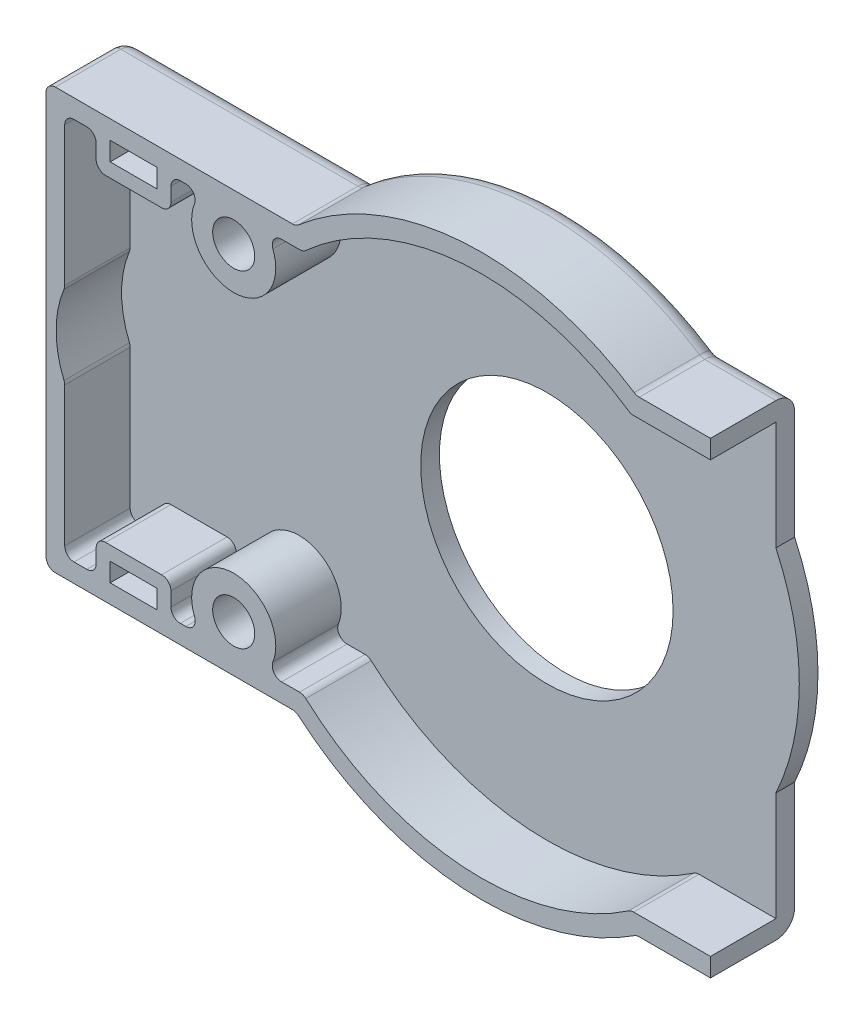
SolidWorks part; units mm, degrees
ref_plane "Спереди" through (0, 0, 0) normal (0, 0, 1) x (1, 0, 0)
ref_plane "Сверху" through (0, 0, 0) normal (0, 1, 0) x (1, 0, 0)
ref_plane "Справа" through (0, 0, 0) normal (1, 0, 0) x (0, 0, -1)
sketch "Эскиз1" plane through (0, 0, 0) normal (0, 0, 1) x (1, 0, 0)
  line L0 (0, 0) -> (24.5, 0) construction
  line L1 (24.5, -25) -> (24.5, -11.3468)
  line L2 (24.5, 25) -> (16.5831, 25)
  line L3 (24.5, -25) -> (16.5831, -25)
  line L4 (16.5831, 25) -> (-16.5831, 25) construction
  line L5 (16.5831, -25) -> (-16.5831, -25) construction
  line L6 (-16.5831, -22.5) -> (-16.5831, 22.5) construction
  line L7 (-16.5831, 0) -> (0, 0) construction
  line L8 (-16.5831, 22.5) -> (-19.8431, 22.5) construction
  line L9 (-16.5831, -22.5) -> (-19.8431, -22.5) construction
  line L10 (-19.8431, 22.5) -> (-46.5831, 22.5)
  line L11 (-46.5831, 22.5) -> (-46.5831, -22.5)
  line L12 (-46.5831, -22.5) -> (-19.8431, -22.5)
  line L13 (-46.5831, 0) -> (-16.5831, 0) construction
  line L17 (0, 30) -> (0, -30) construction
  line L23 (24.5, 11.3468) -> (24.5, 25)
  line L24 (24.5, 11.3468) -> (24.5, 0) construction
  line L25 (24.5, 0) -> (24.5, -11.3468) construction
  circle A0 centre (0, 0) radius 30 construction
  arc A1 (16.5831, 25) -> (-19.8431, 22.5) centre (0, 0) ccw
  arc A2 (-19.8431, -22.5) -> (16.5831, -25) centre (0, 0) ccw
  circle A7 centre (0, 0) radius 13.5
  arc A11 (24.5, 11.3468) -> (24.5, -11.3468) centre (0, 0) cw
  point P7 (24.5, 0)
  point P15 (-16.5831, 0)
  dimension "D1" = 60
  dimension "D4" = 45
  dimension "D6" = 27
  dimension "D11" = 27
  dimension "D2" = 50
  dimension "D3" = 24.5
  dimension "D5" = 30
extrude "Бобышка-Вытянуть1" add sketch "Эскиз1" along normal blind 2 contours L10 L11 L12 A2 L3 L1 L2 A1
sketch "Эскиз2" plane through (0, 0, 2) normal (0, 0, 1) x (1, 0, 0)
  line L7 (24.5, 25) -> (16.5831, 25) construction
  line L10 (16.5831, -25) -> (24.5, -25) construction
  line L11 (-46.5831, -22.5) -> (-19.8431, -22.5) construction
  line L12 (-46.5831, 22.5) -> (-46.5831, -22.5) construction
  line L13 (-19.8431, 22.5) -> (-46.5831, 22.5) construction
  line L21 (24.5, 25) -> (16.5831, 25)
  line L24 (16.5831, -25) -> (24.5, -25)
  line L25 (-46.5831, -22.5) -> (-19.8431, -22.5)
  line L26 (-46.5831, 22.5) -> (-46.5831, -22.5)
  line L27 (-19.8431, 22.5) -> (-46.5831, 22.5)
  line L28 (-19.0722, 20.5) -> (-44.5831, 20.5)
  line L29 (-44.5831, 20.5) -> (-44.5831, -20.5)
  line L30 (-44.5831, -20.5) -> (-19.0722, -20.5)
  line L31 (15.9687, -23) -> (24.5, -23)
  line L34 (24.5, 23) -> (15.9687, 23)
  line L36 (24.5, 11.3468) -> (24.5, 25) construction
  line L37 (24.5, 23) -> (24.5, 25)
  line L39 (24.5, -25) -> (24.5, -11.3468) construction
  line L40 (24.5, -23) -> (24.5, -25)
  line L42 (25.1156, 23) -> (24.5, 23) construction
  line L43 (24.7004, 25) -> (24.5, 25) construction
  line L44 (24.5, -23) -> (25.8064, -23) construction
  line L45 (24.5, -25) -> (25.4219, -25) construction
  arc A7 (16.5831, 25) -> (-19.8431, 22.5) centre (0, 0) ccw construction
  arc A9 (-19.8431, -22.5) -> (16.5831, -25) centre (0, 0) ccw construction
  arc A10 (16.5831, 25) -> (-19.8431, 22.5) centre (0, 0) ccw
  arc A12 (-19.8431, -22.5) -> (16.5831, -25) centre (0, 0) ccw
  arc A13 (-19.0722, -20.5) -> (15.9687, -23) centre (0, 0) ccw
  arc A22 (15.9687, 23) -> (-19.0722, 20.5) centre (0, 0) ccw
  arc A42 (25.8064, -23) -> (25.1156, 23) centre (35.2517, 0.147) ccw construction
  arc A43 (25.4219, -25) -> (24.7004, 25) centre (35.2517, 0.147) ccw construction
  dimension "D1" = 2
extrude "Бобышка-Вытянуть2" add sketch "Эскиз2" along normal blind 7
sketch "Эскиз3" plane through (0, 0, 2) normal (0, 0, 1) x (1, 0, 0)
  line L0 (-26.5031, 0) -> (-46.5831, 0) construction
  line L1 (-46.5831, 22.5) -> (-46.5831, -22.5) construction
  line L2 (-26.5031, 0) -> (-26.5031, 17.5) construction
  line L3 (-26.5031, 0) -> (-26.5031, -17.5) construction
  circle A0 centre (-26.5031, 17.5) radius 4.5
  circle A1 centre (-26.5031, -17.5) radius 4.5
  dimension "D3" = 9
  dimension "D1" = 35
  dimension "D2" = 20.08
extrude "Бобышка-Вытянуть3" add sketch "Эскиз3" along normal up to surface (7 mm away)
sketch "Эскиз4" plane through (0, 0, 9) normal (0, 0, 1) x (1, 0, 0)
  circle A0 centre (-26.5031, 17.5) radius 2.25
  circle A1 centre (-26.5031, -17.5) radius 2.25
  dimension "D1" = 4.5
extrude "Вырез-Вытянуть1" cut sketch "Эскиз4" against normal through all
sketch "Эскиз5" plane through (0, 0, 2) normal (0, 0, 1) x (1, 0, 0)
  line L0 (-46.5831, 0) -> (-34.5031, 0) construction
  line L2 (-46.5831, 22.5) -> (-46.5831, -22.5) construction
  circle A0 centre (-34.5031, 0) radius 11
  dimension "D2" = 22
  dimension "D1" = 12.08
extrude "Вырез-Вытянуть2" cut sketch "Эскиз5" along normal up to surface (7 mm away)
chamfer "Фаска1" distance 2.5 angle 45 2 edges at (-24.2531, -17.5, 0) (-24.2531, 17.5, 0)
sketch "Эскиз6" plane through (0, 0, 2) normal (0, 0, 1) x (1, 0, 0)
  line L0 (0, 0) -> (0, 25) construction
  line L1 (0, 25) -> (-46.5831, 25) construction
  line L2 (-46.5831, 25) -> (-46.5831, 0) construction
  line L3 (-46.5831, 22.5) -> (-46.5831, -22.5) construction
  line L4 (-44.5831, 20.5) -> (-29.8572, 20.5) construction
  line L5 (-41.2202, 17) -> (-33.2202, 17)
  line L6 (-39.7202, 20.5) -> (-34.7202, 20.5)
  line L7 (-39.7202, 20.5) -> (-39.7202, 18.5)
  line L8 (-39.7202, 18.5) -> (-34.7202, 18.5)
  line L9 (-34.7202, 20.5) -> (-34.7202, 18.5)
  line L10 (-33.2202, 22) -> (-33.2202, 17)
  line L11 (-41.2202, 22) -> (-33.2202, 22)
  line L12 (-41.2202, 22) -> (-41.2202, 17)
  line L13 (-46.5831, 0) -> (0, 0) construction
  line L14 (-34.7202, -20.5) -> (-34.7202, -18.5)
  line L15 (-39.7202, -18.5) -> (-34.7202, -18.5)
  line L16 (-39.7202, -20.5) -> (-39.7202, -18.5)
  line L17 (-39.7202, -20.5) -> (-34.7202, -20.5)
  line L18 (-41.2202, -22) -> (-41.2202, -17)
  line L19 (-41.2202, -22) -> (-33.2202, -22)
  line L20 (-41.2202, -17) -> (-33.2202, -17)
  line L21 (-33.2202, -22) -> (-33.2202, -17)
  point P13 (-37.2202, 20.5)
  point P14 (-37.2202, 20.5)
  dimension "D1" = 25
  dimension "D2" = 5
  dimension "D3" = 2
  dimension "D4" = 1.5
extrude "Бобышка-Вытянуть4" add sketch "Эскиз6" along normal up to surface (7 mm away)
fillet "Скругление3" radius 1 26 edges at (16.5831, -25, 4.5) (-19.8431, -22.5, 4.5) (16.5831, 25, 4.5) (-19.8431, 22.5, 4.5) (-46.5831, -22.5, 4.5) (-46.5831, 22.5, 4.5) (-44.5831, 20.5, 5.5) (-44.5831, -20.5, 5.5) (-19.0722, -20.5, 5.5) (15.9687, -23, 5.5) (15.9687, 23, 5.5) (-19.0722, 20.5, 5.5) (-23.149, 20.5, 5.5) (-29.8572, 20.5, 5.5) (-29.8572, -20.5, 5.5) (-23.149, -20.5, 5.5) (-44.5831, 4.4038, 5.5) (-44.5831, -4.4038, 5.5) (-33.2202, 20.5, 5.5) (-33.2202, 17, 5.5) (-41.2202, 20.5, 5.5) (-41.2202, 17, 5.5) (-41.2202, -20.5, 5.5) (-33.2202, -17, 5.5) (-33.2202, -20.5, 5.5) (-41.2202, -17, 5.5)
fillet "Скругление4" radius 2 13 edges at (16.598, 25.0412, 0) (20.691, 25, 0) (20.691, -25, 0) (16.598, -25.0412, 0) (-2.017, -29.9321, 0) (-19.8698, -22.5624, 0) (-32.9003, -22.5, 0) (-46.2902, -22.2071, 0) (-46.5831, 0, 0) (-46.2902, 22.2071, 0) (-32.9003, 22.5, 0) (-19.8698, 22.5624, 0) (-2.017, 29.9321, 0)
